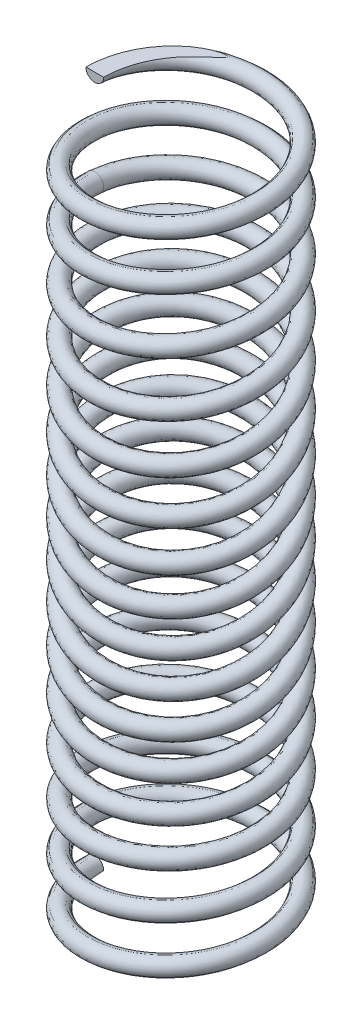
SolidWorks part; units mm, degrees
ref_plane "Front" through (0, 0, 0) normal (0, 0, 1) x (1, 0, 0)
ref_plane "Top" through (0, 0, 0) normal (0, 1, 0) x (1, 0, 0)
ref_plane "Right" through (0, 0, 0) normal (1, 0, 0) x (0, 0, -1)
ref_plane "Plane1" through (0, 25.4, 0) normal (0, 1, 0) x (1, 0, 0)
sketch "Sketch2" plane through (0, 0, 0) normal (0, 0, 1) x (1, 0, 0)
  line L0 (0, 0) -> (0, 25.4)
  line L1 (23.8329, 25.4) -> (-23.8329, 25.4) construction
  point P3 (0, 0)
sketch "Sketch3" plane through (0, 0, 0) normal (0, 0, 1) x (1, 0, 0)
  line L0 (0, 0) -> (0, -19.0802) construction
  circle A0 centre (-23.0187, 0) radius 2.3813
  point P5 (0, 0)
  dimension "D1" = 4.7625
  dimension "D2" = 50.8
sweep "Sweep1" add profiles "Sketch3" path "Sketch2" parameters "D4"=720
ref_plane "Plane2" through (0, 208.8333, 0) normal (0, -1, 0) x (-1, 0, 0)
sketch "Sketch1" plane through (0, 208.8333, 0) normal (0, -1, 0) x (-1, 0, 0)
  circle A0 centre (-25.4, -25.4) radius 25.4 construction
  circle A1 centre (-25.4, -25.4) radius 25.4
ref_plane "Plane3" through (0, 183.4333, 0) normal (0, -1, 0) x (-1, 0, 0)
sketch3d "3DSketch1"
  line L0 (25.4, 208.8333, 25.4) -> (25.4, 183.4333, 25.4)
  point P3 (0, 0, 0)
  point P4 (0, 0, 0)
sketch3d "3DSketch2"
  line L1 (25.4, 208.8333, 25.4) -> (25.4, 183.4333, 25.4) construction
  line L2 (0, 0, 0) -> (0, 25.4, 0) construction
  spline S0 degree 3 poles (25.4, 183.4333, 25.4) (25.4, 126.7882, 25.4) (0, 79.4214, 0) (0, 25.4, 0) knots 0 0 0 0 1 1 1 1
  point P2 (0, 25.4, 0)
  point P3 (-3.84, 24.1207, -1.0792)
sketch "Sketch4" plane through (0, 0, 0) normal (0, 0, 1) x (1, 0, 0)
  circle A1 centre (-23.0187, 25.4) radius 2.3813
  circle A3 centre (-23.0187, 25.4) radius 2.3813
  dimension "D1" = 0
sweep "Sweep2" add profiles "Sketch4" path "3DSketch2" parameters "D4"=4320
sketch "Sketch5" plane through (0, 0, 25.4) normal (0, 0, 1) x (1, 0, 0)
  circle A1 centre (2.3812, 183.4333) radius 2.3813
  circle A2 centre (2.3812, 183.4333) radius 2.3812
  dimension "D1" = 0
sweep "Sweep3" add profiles "Sketch5" path "3DSketch1" parameters "D4"=720
other "SurfaceCut1"
other "SurfaceCut2"
